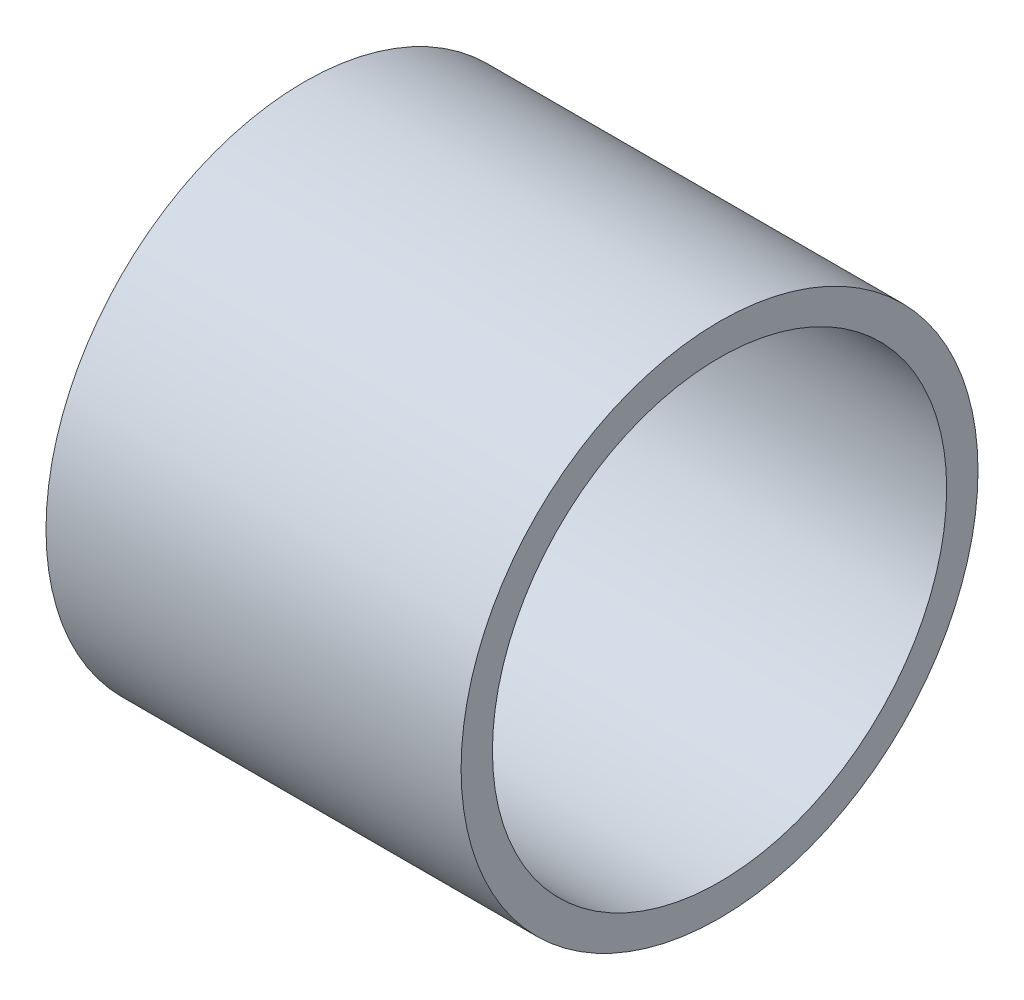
SolidWorks part; units mm, degrees
ref_plane "Face" through (0, 0, 0) normal (0, 0, 1) x (1, 0, 0)
ref_plane "Dessus" through (0, 0, 0) normal (0, 1, 0) x (1, 0, 0)
ref_plane "Droite" through (0, 0, 0) normal (1, 0, 0) x (0, 0, -1)
sketch "Esquisse1" plane through (0, 0, 0) normal (0, 0, 1) x (1, 0, 0)
  line L0 (0, 0) -> (127.2375, 0) construction
  line L1 (0, 33) -> (53, 33)
  line L2 (0, 33) -> (0, 29)
  line L3 (0, 29) -> (53, 29)
  line L4 (53, 33) -> (53, 29)
  dimension "D1" = 66
  dimension "D2" = 58
  dimension "D3" = 53
revolve "Révolution1" add sketch "Esquisse1" angle 360 about L0
